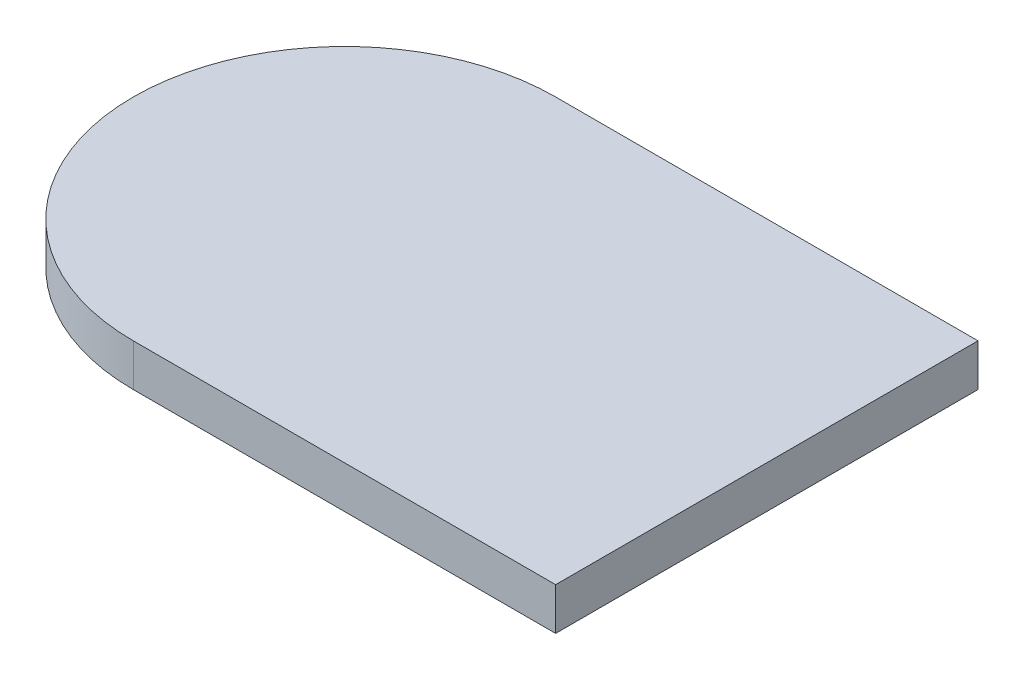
SolidWorks part; units mm, degrees
ref_plane "Front Plane" through (0, 0, 0) normal (0, 0, 1) x (1, 0, 0)
ref_plane "Top Plane" through (0, 0, 0) normal (0, 1, 0) x (1, 0, 0)
ref_plane "Right Plane" through (0, 0, 0) normal (1, 0, 0) x (0, 0, -1)
sketch "Sketch1" plane through (0, 0, 0) normal (0, 1, 0) x (1, 0, 0)
  line L0 (0, 0) -> (-50, 0)
  line L1 (-50, 50) -> (0, 50)
  line L2 (0, 50) -> (0, 0)
  arc A0 (-50, 0) -> (-50, 50) centre (-50, 25) cw
  dimension "D1" = 50
  dimension "D2" = 50
extrude "Extrude1" add sketch "Sketch1" along normal blind 5
